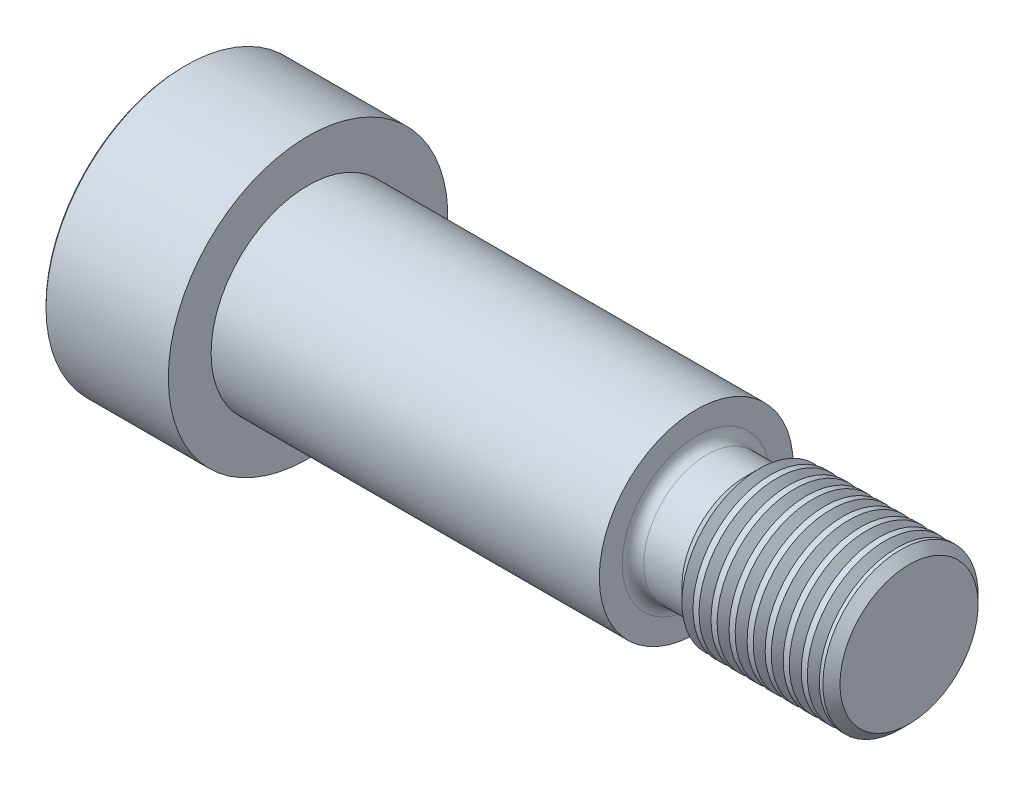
SolidWorks part; units mm, degrees
ref_plane "Plane1" through (0, 0, 0) normal (0, 0, 1) x (1, 0, 0)
ref_plane "Plane2" through (0, 0, 0) normal (0, 1, 0) x (1, 0, 0)
ref_plane "Plane3" through (0, 0, 0) normal (1, 0, 0) x (0, 0, -1)
sketch "BodySke" plane through (0, 0, 0) normal (0, 0, 1) x (1, 0, 0)
  line L0 (0, 0) -> (0, 18)
  line L2 (0, 18) -> (16, 18)
  line L3 (16, 18) -> (16, 12.49)
  line L6 (16, 12.49) -> (66, 12.49)
  line L7 (66, 12.49) -> (66, 9.53)
  line L8 (67.38, 8.15) -> (72.3, 8.15)
  line L9 (72.3, 8.15) -> (74.15, 10)
  line L10 (74.15, 10) -> (92.2985, 10)
  line L11 (92.2985, 10) -> (93.4, 8.8985)
  line L12 (93.4, 8.8985) -> (93.4, 0)
  line L13 (93.4, 0) -> (0, 0)
  line L14 (-6.35, 0) -> (107.95, 0) construction
  line L15 (92.2985, -10) -> (93.4, -8.8985) construction
  line L16 (66, -8.15) -> (72.3, -8.15) construction
  line L17 (16, -12.49) -> (66, -12.49) construction
  line L20 (74.8, 13.0014) -> (74.8, -4.3514) construction
  line L21 (70.54, 7.0856) -> (70.54, -8.764) construction
  arc A0 (66, 9.53) -> (67.38, 8.15) centre (67.38, 9.53) ccw
  point P29 (66, 8.15)
  dimension "Thread_neck_fillet_rad" = 1.38
  dimension "Head_dia" = 36
  dimension "Head_ht" = 16
  dimension "Diameter" = 24.98
  dimension "Thread_dia" = 20
  dimension "Minor_dia" = 17.797
  dimension "Thread_ch_ang" = 45
  dimension "Thread_neck_dia" = 16.3
  dimension "D11" = 45
  dimension "Thread_length" = 27.4
  dimension "Length" = 50
  dimension "Thread_neck_width" = 6.3
  dimension "Advance" = 2.5
  dimension "Thread_nom" = 22.86
  dimension "Thread_lim" = 18.6
revolve "BaseBody" add sketch "BodySke"
pattern_linear "ThdSchPat" count 8 spacing 2.325 along (1, 0, 0)
revolve "ThreadSchematic" cut sketch "ThdSchSke" angle 360 about L3
sketch "ThdSchSke" plane through (0, 0, 0) normal (0, 0, 1) x (1, 0, 0)
  line L0 (74.8, -8.8985) -> (72.2852, -12.49)
  line L1 (74.8, -8.8985) -> (77.3148, -12.49)
  line L2 (77.3148, -12.49) -> (77.3148, -15.6125)
  line L3 (-3.175, 0) -> (5.1513, 0) construction
  line L5 (77.3148, -15.6125) -> (72.2852, -15.6125)
  line L6 (72.2852, -15.6125) -> (72.2852, -12.49)
  dimension "Thread_minor" = 17.797
  dimension "Diameter" = 24.98
  dimension "Start" = 74.8
  dimension "SideAngle" = 55
  dimension "VeeAngle" = 70
  dimension "Overcut" = 31.225
chamfer "Chamfer1" distance 0.25 1 edges at (0, 0, 18)
sketch "Sketch2" plane through (0, 0, 0) normal (0, 0, 1) x (1, 0, 0)
  line L0 (0, 6) -> (10, 6)
  line L1 (10, 6) -> (13.4641, 0)
  line L3 (13.4641, 0) -> (0, 0)
  line L4 (0, 0) -> (0, 6)
  line L5 (0, -6) -> (10, -6) construction
  line L6 (0, 0) -> (47.625, 0) construction
  dimension "D2" = 60
  dimension "PreBroach_depth" = 10
  dimension "PreBroach_dia" = 12
revolve "PreBroach" cut sketch "Sketch2" angle 360 about L6
sketch "Sketch3" plane through (0, 0, 0) normal (-1, 0, 0) x (0, 0, 1)
  line L0 (-6, -3.4641) -> (-6, 3.4641)
  line L1 (-6, 3.4641) -> (0, 6.9282)
  line L2 (0, 6.9282) -> (6, 3.4641)
  line L3 (6, 3.4641) -> (6, -3.4641)
  line L4 (6, -3.4641) -> (0, -6.9282)
  line L5 (0, -6.9282) -> (-6, -3.4641)
  dimension "D1" = 6
  dimension "Hex_size" = 12
  dimension "D2" = 6
  dimension "D3" = 120
  dimension "D4" = 12
extrude "Hex" cut sketch "Sketch3" against normal blind 10
equation "\"Thread_minor@ThreadCosmetic\" = \"Minor_dia@BodySke\""
equation "\"D1@Sketch3\" = \"Hex_size@Sketch3\" / 2"
equation "\"D2@Sketch3\" = \"D1@Sketch3\""
equation "\"D4@Sketch3\" = \"Hex_size@Sketch3\""
equation "\"Thread_length@ThreadCosmetic\" = ((sgn( (\"Thread_length@BodySke\" - \"Advance@BodySke\" - \"Thread_neck_width@BodySke\" ) - \"Thread_nom@BodySke\" )-1)*( (\"Thread_length@BodySke\" - \"Advance@BodySke\" - \"Threa"
equation "\"Thread_minor@ThdSchSke\" = \"Minor_dia@BodySke\""
equation "\"Diameter@ThdSchSke\" = \"Diameter@BodySke\""
equation "\"Overcut@ThdSchSke\" = \"Diameter@BodySke\" * 1.25"
equation "\"Start@ThdSchSke\" = \"Head_ht@BodySke\" + \"Length@BodySke\" + \"Thread_length@BodySke\" -  \"Thread_length@ThreadCosmetic\"  '---Non-countersunk---"
equation "\"Num_threads@ThdSchPat\" = int( \"Thread_length@ThreadCosmetic\" / \"Advance@BodySke\" + 0.999 ) + 1"
equation "\"Advance@ThdSchPat\" = \"Thread_length@ThreadCosmetic\" /  (\"Num_threads@ThdSchPat\" - 1) 'relax it"
equation "\"Num_threads@ThdSchPat\" = \"Num_threads@ThdSchPat\" - sgn( \"Num_threads@ThdSchPat\" - 1) '---chamfered tips only---"
